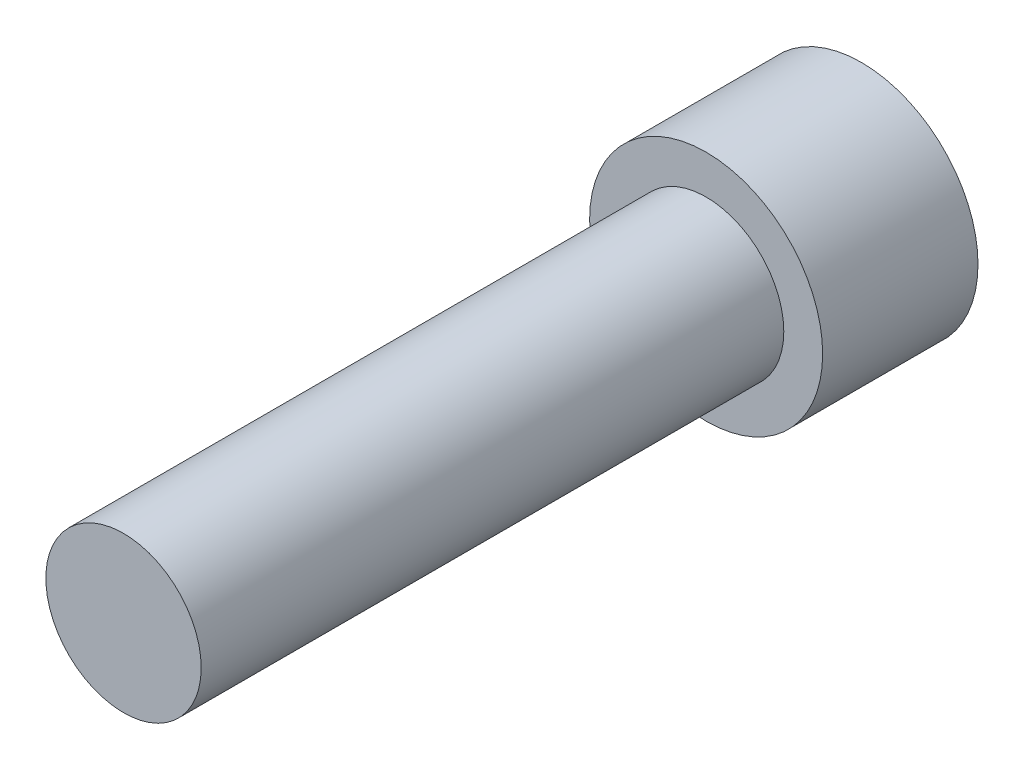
SolidWorks part; units mm, degrees
ref_plane "Front Plane" through (0, 0, 0) normal (0, 0, 1) x (1, 0, 0)
ref_plane "Top Plane" through (0, 0, 0) normal (0, 1, 0) x (1, 0, 0)
ref_plane "Right Plane" through (0, 0, 0) normal (1, 0, 0) x (0, 0, -1)
sketch "Sketch6" plane through (0, 0, 0) normal (1, 0, 0) x (0, 0, -1)
  line L0 (-45, 0) -> (22.525, 0) construction
  line L1 (9.9, 0) -> (-9.9, 0) construction
  line L2 (-45, 0) -> (-45, -6)
  line L3 (-45, -6) -> (0, -6)
  line L4 (0, 9.9) -> (0, -9.9) construction
  line L5 (0, -6) -> (0, -9)
  line L6 (0, -9) -> (12, -9)
  line L7 (12, -9) -> (12, 0)
  line L8 (12, 0) -> (-45, 0)
  dimension "L" = 45
  dimension "H" = 12
  dimension "A" = 18
  dimension "D" = 12
revolve "Revolve1" add sketch "Sketch6" angle 360 about L0
sketch "Sketch7" plane through (0, 0, -12) normal (0, 0, -1) x (-1, 0, 0)
  line L2 (-5, 2.8868) -> (-5, -2.8868)
  line L4 (-5, -2.8868) -> (0, -5.7735)
  line L5 (0, -5.7735) -> (5, -2.8868)
  line L6 (5, -2.8868) -> (5, 2.8868)
  line L7 (5, 2.8868) -> (0, 5.7735)
  line L8 (0, 5.7735) -> (-5, 2.8868)
  circle A0 centre (0, 0) radius 5 construction
  dimension "J" = 10
extrude "HEX" cut sketch "Sketch7" against normal blind 10
